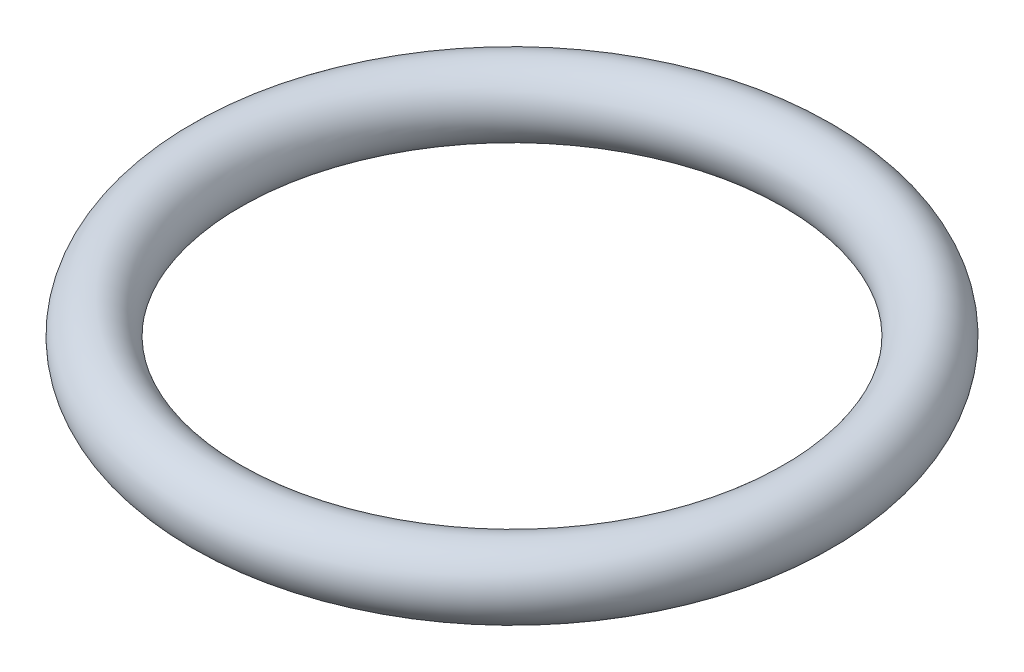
SolidWorks part; units mm, degrees
ref_plane "Plan de face" through (0, 0, 0) normal (0, 0, 1) x (1, 0, 0)
ref_plane "Plan de dessus" through (0, 0, 0) normal (0, 1, 0) x (1, 0, 0)
ref_plane "Plan de droite" through (0, 0, 0) normal (1, 0, 0) x (0, 0, -1)
sketch "Esquisse1" plane through (0, 0, 0) normal (0, 0, 1) x (1, 0, 0)
  line L0 (0, 44.0096) -> (0, -35.2484) construction
  circle A0 centre (4.35, 0) radius 0.5
  dimension "D1" = 1
  dimension "D2" = 4.35
revolve "Révolution1" add sketch "Esquisse1" angle 360 about L0
